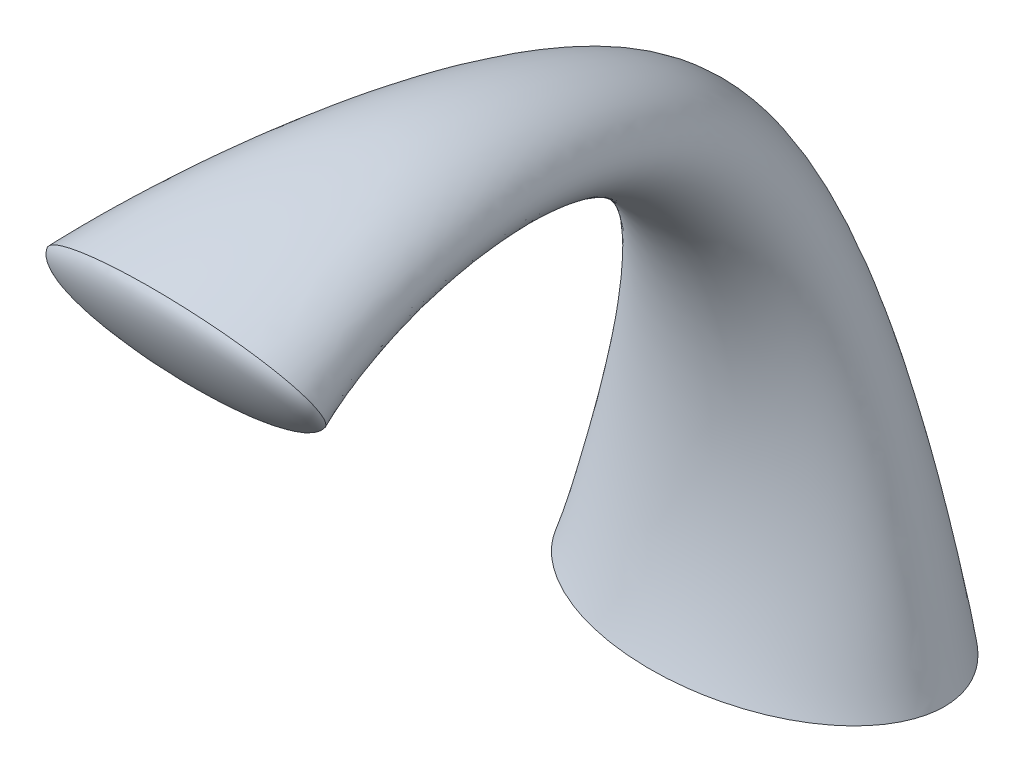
SolidWorks part; units mm, degrees
ref_plane "Front Plane" through (0, 0, 0) normal (0, 0, 1) x (1, 0, 0)
ref_plane "Top Plane" through (0, 0, 0) normal (0, 1, 0) x (1, 0, 0)
ref_plane "Right Plane" through (0, 0, 0) normal (1, 0, 0) x (0, 0, -1)
imported_body "Imported1"
other "DeleteFace1"
other "DeleteFace2"
